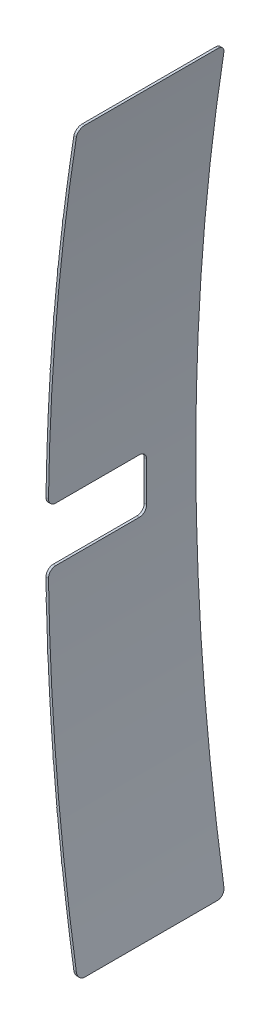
SolidWorks part; units mm, degrees
ref_plane "前视基准面" through (0, 0, 0) normal (0, 0, 1) x (1, 0, 0)
ref_plane "上视基准面" through (0, 0, 0) normal (0, 1, 0) x (1, 0, 0)
ref_plane "右视基准面" through (0, 0, 0) normal (1, 0, 0) x (0, 0, -1)
sketch "草图1" plane through (0, 0, 0) normal (0, 0, 1) x (1, 0, 0)
  line L0 (-94.0007, 15) -> (-93.8995, 15)
  line L1 (-94.0007, -15) -> (-93.8995, -15)
  line L2 (-1000, 0) -> (49000, 0) construction
  arc A0 (-94.0007, 15) -> (-94.0007, -15) centre (0, 0) ccw
  arc A1 (-93.8995, 15) -> (-93.8995, -15) centre (0, 0) ccw
  dimension "D1" = 190.38
  dimension "D2" = 190.18
  dimension "D3" = 30
extrude "凸台-拉伸1" add sketch "草图1" along normal blind 6
ref_plane "基准面1" through (-50, 0, 0) normal (1, 0, 0) x (0, 0, -1)
sketch "草图4" plane through (0, 0, 0) normal (1, 0, 0) x (0, 0, -1)
  line L0 (-6, -1.1) -> (-2, -1.1)
  line L1 (-6, 15) -> (-6, -15) construction
  line L2 (-2, -1.1) -> (-2, 1.1)
  line L3 (-2, 1.1) -> (-6, 1.1)
  line L4 (-6, 1.1) -> (-6, -1.1)
  line L5 (-1000, 0) -> (49000, 0) construction
  dimension "D1" = 4
  dimension "D2" = 2.2
extrude "切除-拉伸1" cut sketch "草图4" against normal through all
fillet "圆角1" radius 0.3 8 edges at (-93.9501, -15, 6) (-93.9501, -15, 0) (-93.9501, 15, 6) (-93.9501, 15, 0) (-95.1336, -1.1, 2) (-95.1336, 1.1, 2) (-95.1336, 1.1, 6) (-95.1336, -1.1, 6)
sketch "草图5" plane through (-50, 0, 0) normal (1, 0, 0) x (0, 0, -1)
  line L0 (0, -2.8572) -> (0, 3.1428)
  line L1 (0, 3.1428) -> (-2, 0.1428)
  line L2 (-2, 0.1428) -> (0, -2.8572)
  line L3 (-1002, 0.1428) -> (48998, 0.1428) construction
  line L4 (0, -14.7) -> (0, 14.7) construction
  line L5 (-2, 0.8) -> (-2, -0.8) construction
  line L6 (-6, -1.4) -> (-6, -14.7) construction
  line L7 (-6, -2.3) -> (-2, -2.3)
  line L8 (-6, -2.3) -> (-6, -2.1)
  line L9 (-6, -2.1) -> (-2, -2.1)
  line L10 (-2, -2.3) -> (-2, -2.1)
  line L31 (-5.7, -1.1) -> (-2.3, -1.1) construction
  line L56 (-6, -4.1) -> (-2, -4.1)
  line L57 (-6, -4.1) -> (-6, -3.9)
  line L58 (-6, -3.9) -> (-2, -3.9)
  line L59 (-2, -4.1) -> (-2, -3.9)
  line L60 (-6, -5.9) -> (-2, -5.9)
  line L61 (-6, -5.9) -> (-6, -5.7)
  line L62 (-6, -5.7) -> (-2, -5.7)
  line L63 (-2, -5.9) -> (-2, -5.7)
  line L64 (-6, -7.7) -> (-2, -7.7)
  line L65 (-6, -7.7) -> (-6, -7.5)
  line L66 (-6, -7.5) -> (-2, -7.5)
  line L67 (-2, -7.7) -> (-2, -7.5)
  line L68 (-6, -9.5) -> (-2, -9.5)
  line L69 (-6, -9.5) -> (-6, -9.3)
  line L70 (-6, -9.3) -> (-2, -9.3)
  line L71 (-2, -9.5) -> (-2, -9.3)
  line L72 (-6, -11.3) -> (-2, -11.3)
  line L73 (-6, -11.3) -> (-6, -11.1)
  line L74 (-6, -11.1) -> (-2, -11.1)
  line L75 (-2, -11.3) -> (-2, -11.1)
  line L76 (-6, -2.3) -> (-6, -4.1) construction
  line L77 (-6, 2.5855) -> (-6, 4.3855) construction
  line L78 (-2, 11.5855) -> (-2, 11.3855)
  line L79 (-6, 11.3855) -> (-2, 11.3855)
  line L80 (-6, 11.5855) -> (-6, 11.3855)
  line L81 (-6, 11.5855) -> (-2, 11.5855)
  line L82 (-2, 9.7855) -> (-2, 9.5855)
  line L83 (-6, 9.5855) -> (-2, 9.5855)
  line L84 (-6, 9.7855) -> (-6, 9.5855)
  line L85 (-6, 9.7855) -> (-2, 9.7855)
  line L86 (-2, 7.9855) -> (-2, 7.7855)
  line L87 (-6, 7.7855) -> (-2, 7.7855)
  line L88 (-6, 7.9855) -> (-6, 7.7855)
  line L89 (-6, 7.9855) -> (-2, 7.9855)
  line L90 (-2, 6.1855) -> (-2, 5.9855)
  line L91 (-6, 5.9855) -> (-2, 5.9855)
  line L92 (-6, 6.1855) -> (-6, 5.9855)
  line L93 (-6, 6.1855) -> (-2, 6.1855)
  line L94 (-2, 4.3855) -> (-2, 4.1855)
  line L95 (-6, 4.1855) -> (-2, 4.1855)
  line L96 (-6, 4.3855) -> (-6, 4.1855)
  line L97 (-6, 4.3855) -> (-2, 4.3855)
  line L98 (-2, 2.5855) -> (-2, 2.3855)
  line L99 (-6, 2.3855) -> (-2, 2.3855)
  line L100 (-6, 2.5855) -> (-6, 2.3855)
  line L101 (-6, 2.5855) -> (-2, 2.5855)
  line L102 (-5.7, -15) -> (-0.3, -15) construction
  line L103 (-4.5, -13.3) -> (-3.1, -13.3)
  line L104 (-4.5, -13.3) -> (-4.5, -13.5)
  line L105 (-4.5, -13.5) -> (-3.1, -13.5)
  line L106 (-1.5, -13.3) -> (-1.5, -13.5)
  line L107 (-6, 14.7) -> (-6, 1.4) construction
  line L108 (-3.1, -11.9) -> (-2.9, -11.9)
  line L109 (-3.1, -11.9) -> (-3.1, -13.3)
  line L110 (-3.1, -14.9) -> (-2.9, -14.9)
  line L111 (-2.9, -11.9) -> (-2.9, -13.3)
  line L112 (-3.1, 14.8573) -> (-2.9, 14.8573)
  line L113 (-3.1, 14.8573) -> (-3.1, 11.8573)
  line L114 (-3.1, 11.8573) -> (-2.9, 11.8573)
  line L115 (-2.9, 14.8573) -> (-2.9, 11.8573)
  line L116 (-2.9, -13.3) -> (-1.5, -13.3)
  line L117 (-2.9, -13.5) -> (-1.5, -13.5)
  line L118 (-3.1, -13.5) -> (-3.1, -14.9)
  line L119 (-2.9, -13.5) -> (-2.9, -14.9)
  point P77 (-3, 11.8573)
  dimension "D1" = 6
  dimension "D2" = 0.2
  dimension "D3" = 6
  dimension "D5" = 1
  dimension "D4" = 1.8
  dimension "D6" = 3
  dimension "D7" = 0.2
  dimension "D8" = 1.5
  dimension "D9" = 1.5
  dimension "D10" = 3
  dimension "D11" = 0.2
  dimension "D12" = 1.4
  dimension "D13" = 1.4
  dimension "D14" = 3
  dimension "D15" = 0.1
  dimension "D16" = 2.9
wrap "包覆1" sketch "草图5" wrap type emboss source sketch "草图5" thickness 0.01 parameters "D1"=0.01
